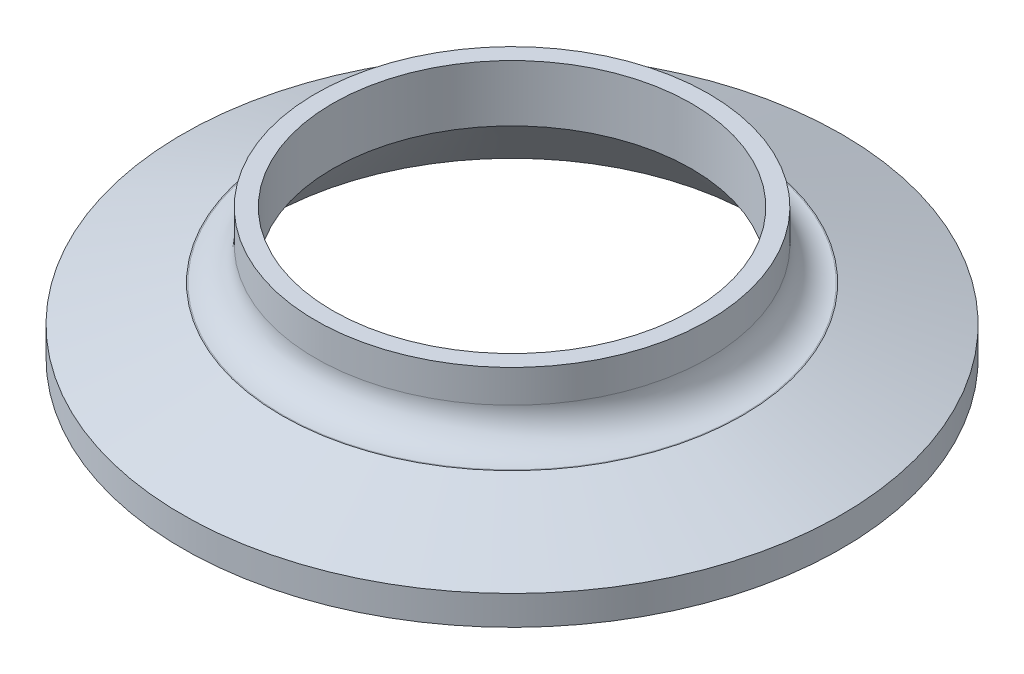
SolidWorks part; units mm, degrees
ref_plane "Front Plane" through (0, 0, 0) normal (0, 0, 1) x (1, 0, 0)
ref_plane "Top Plane" through (0, 0, 0) normal (0, 1, 0) x (1, 0, 0)
ref_plane "Right Plane" through (0, 0, 0) normal (1, 0, 0) x (0, 0, -1)
sketch "Sketch1" plane through (0, 0, 0) normal (0, 0, 1) x (1, 0, 0)
  line L0 (0, 0) -> (0, 8.8532) construction
  line L1 (-19.05, 12.7) -> (-19.05, 9.525)
  line L2 (-22.225, 6.35) -> (-22.3227, 6.35)
  line L3 (-22.3227, 6.35) -> (-31.9532, 2.8448)
  line L4 (-31.9532, 2.8448) -> (-31.9532, 0)
  line L5 (-31.9532, 0) -> (-30.1592, 0.0025)
  line L6 (-23.749, 0) -> (-26.178, 0.0025)
  line L10 (-23.749, 0) -> (-17.399, 7.2128)
  line L11 (-17.399, 7.2128) -> (-17.399, 12.7)
  line L12 (-17.399, 12.7) -> (-19.05, 12.7)
  line L15 (-29.2675, 0.8754) -> (-29.4344, 0.4823)
  line L17 (-27.0697, 0.8754) -> (-26.9028, 0.4823)
  arc A0 (-22.225, 6.35) -> (-19.05, 9.525) centre (-22.225, 9.525) ccw
  arc A1 (-29.4344, 0.4823) -> (-30.1592, 0.0025) centre (-30.1592, 0.7899) cw
  arc A2 (-26.178, 0.0025) -> (-26.9028, 0.4823) centre (-26.178, 0.7899) cw
  arc A3 (-27.0697, 0.8754) -> (-29.2675, 0.8754) centre (-28.1686, 0.4089) ccw
  dimension "D3" = 3.175
  dimension "D7" = 0.7874
  dimension "D8" = 28.1686
  dimension "D9" = 0.7874
  dimension "D2" = 17.399
  dimension "D4" = 12.7
  dimension "D5" = 6.35
  dimension "D6" = 31.9532
  dimension "D10" = 20
  dimension "D11" = 23.749
  dimension "D12" = 19.05
  dimension "D13" = 2.8448
  dimension "D14" = 41.36
revolve "Revolve1" add sketch "Sketch1" angle 360 about L0
